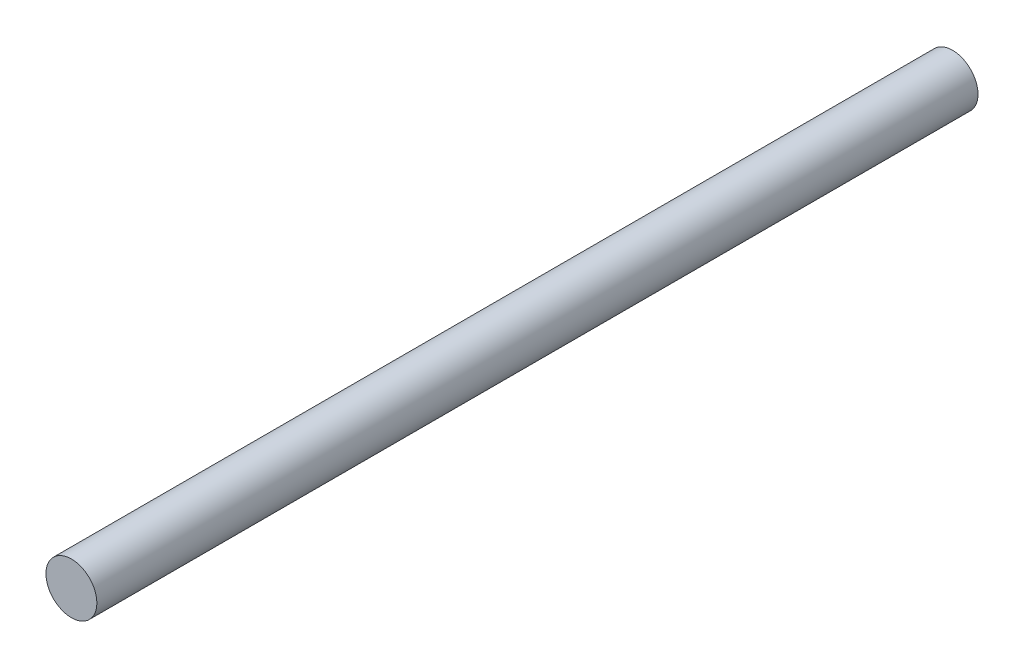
SolidWorks part; units mm, degrees
ref_plane "Front Plane" through (0, 0, 0) normal (0, 0, 1) x (1, 0, 0)
ref_plane "Top Plane" through (0, 0, 0) normal (0, 1, 0) x (1, 0, 0)
ref_plane "Right Plane" through (0, 0, 0) normal (1, 0, 0) x (0, 0, -1)
sketch "Sketch1" plane through (0, 0, 0) normal (0, 0, 1) x (1, 0, 0)
  circle A0 centre (0, 0) radius 6.5
  dimension "D1" = 13
extrude "Boss-Extrude1" add sketch "Sketch1" along normal blind 225
